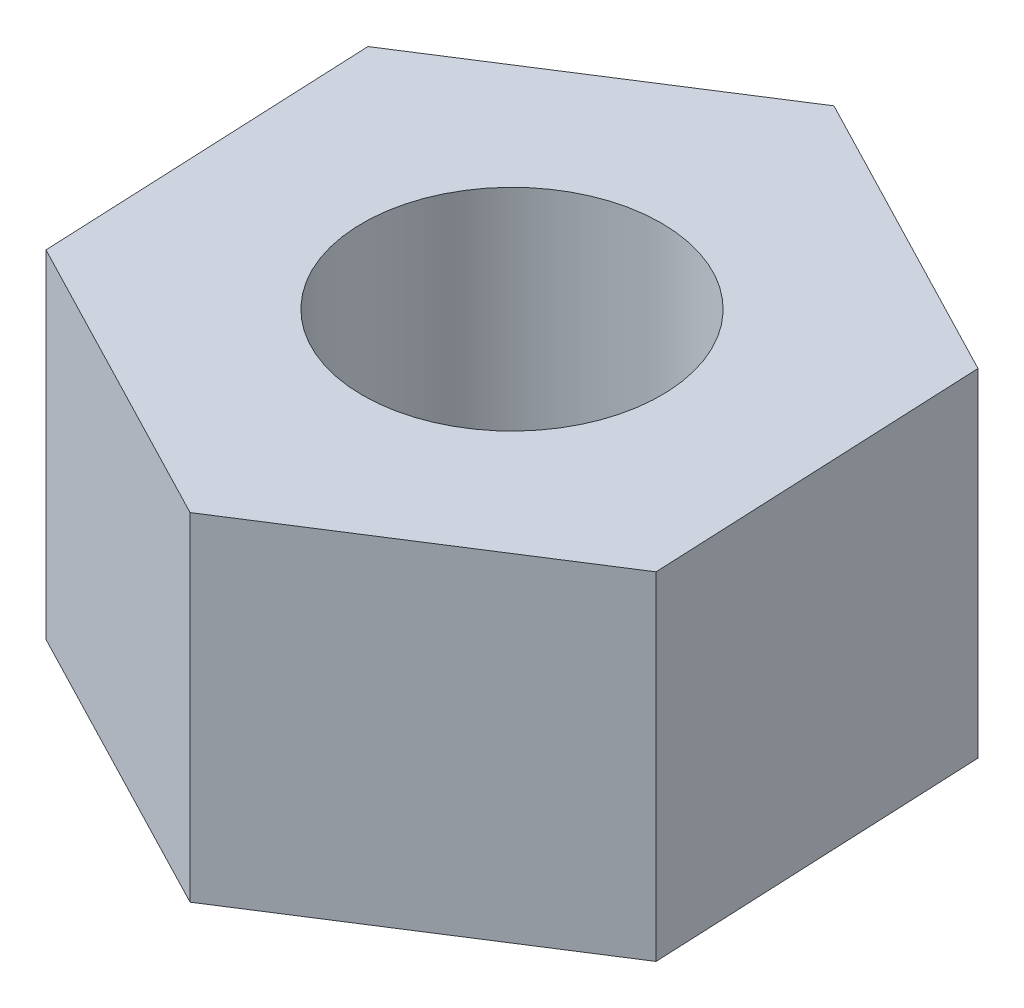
SolidWorks part; units mm, degrees
ref_plane "Front Plane" through (0, 0, 0) normal (0, 0, 1) x (1, 0, 0)
ref_plane "Top Plane" through (0, 0, 0) normal (0, 1, 0) x (1, 0, 0)
ref_plane "Right Plane" through (0, 0, 0) normal (1, 0, 0) x (0, 0, -1)
sketch "Sketch1" plane through (0, 0, 0) normal (0, -1, 0) x (1, 0, 0)
  line L1 (-104.0299, 51.438) -> (-103.8019, 56.5129)
  line L2 (-103.8019, 56.5129) -> (-108.0829, 59.2478)
  line L3 (-108.0829, 59.2478) -> (-112.5919, 56.9077)
  line L4 (-112.5919, 56.9077) -> (-112.8198, 51.8328)
  line L5 (-112.8198, 51.8328) -> (-108.5388, 49.098)
  line L6 (-108.5388, 49.098) -> (-104.0299, 51.438)
  circle A0 centre (-108.3109, 54.1729) radius 4.3994 construction
  circle A1 centre (-108.3109, 54.1729) radius 2.2479
  dimension "D1" = 5.08
extrude "Boss-Extrude1" add sketch "Sketch1" along normal blind 5.08
